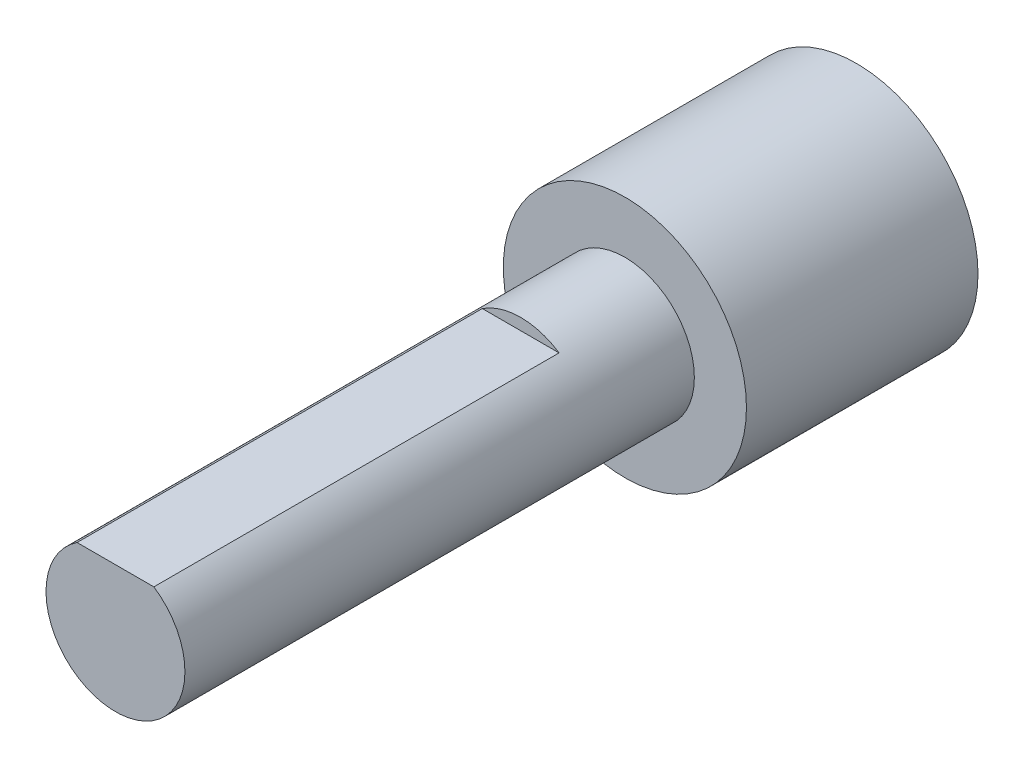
SolidWorks part; units mm, degrees
ref_plane "Piano frontale" through (0, 0, 0) normal (0, 0, 1) x (1, 0, 0)
ref_plane "Piano superiore" through (0, 0, 0) normal (0, 1, 0) x (1, 0, 0)
ref_plane "Piano destro" through (0, 0, 0) normal (1, 0, 0) x (0, 0, -1)
sketch "Schizzo1" plane through (0, 0, 0) normal (0, 0, 1) x (1, 0, 0)
  circle A0 centre (0, 0) radius 5.25
  dimension "D1" = 10.5
extrude "Estrusione-Estrusione1" add sketch "Schizzo1" along normal blind 10
sketch "Schizzo2" plane through (0, 0, 10) normal (0, 0, 1) x (1, 0, 0)
  circle A0 centre (0, 0) radius 3
  dimension "D1" = 6
extrude "Estrusione-Estrusione2" add sketch "Schizzo2" along normal blind 22
sketch "Schizzo3" plane through (0, 0, 32) normal (0, 0, 1) x (1, 0, 0)
  line L1 (-3, 3.5) -> (3, 3.5)
  line L2 (-3, 3.5) -> (-3, 2.5)
  line L3 (-3, 2.5) -> (3, 2.5)
  line L4 (3, 3.5) -> (3, 2.5)
  line L5 (-3, 3.5) -> (3, 2.5) construction
  line L6 (-3, 2.5) -> (3, 3.5) construction
  circle A0 centre (0, 0) radius 3 construction
  circle A1 centre (0, 0) radius 3 construction
  point P0 (0, 3)
  dimension "D1" = 2.5
  dimension "D2" = 6
  dimension "D3" = 1
extrude "Taglio-Estrusione1" cut sketch "Schizzo3" against normal blind 17.5
equation "\"D1@Estrusione-Estrusione2\"=10+24/2"
equation "\"D1@Taglio-Estrusione1\"=5+25/2"
